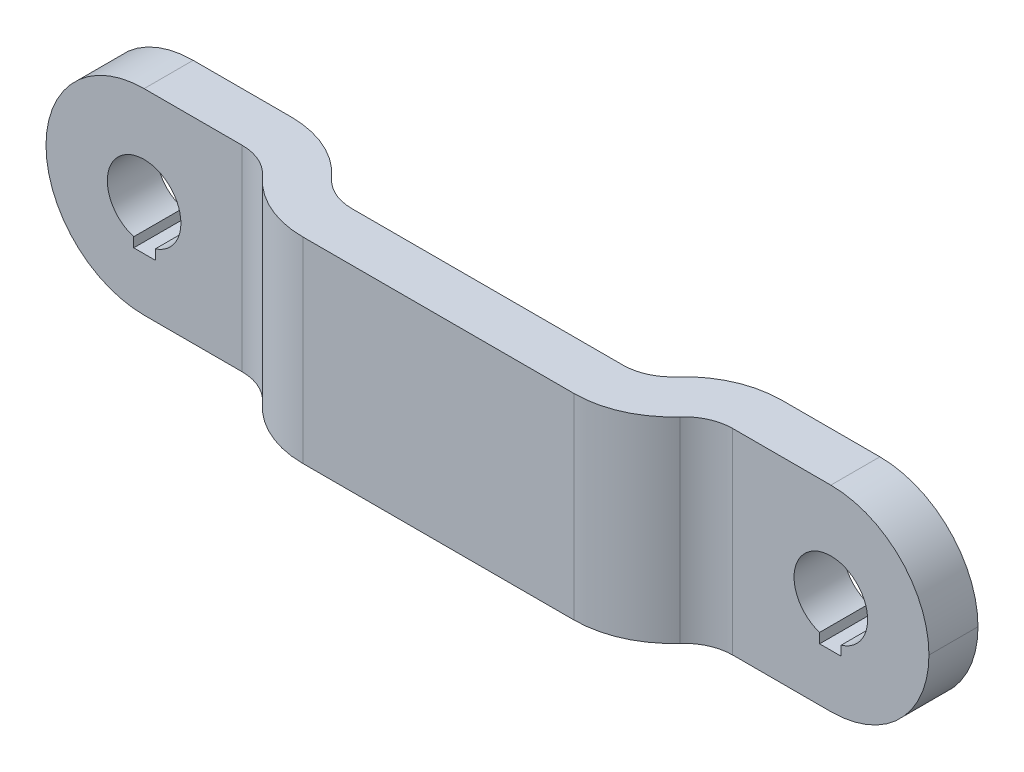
SolidWorks part; units mm, degrees
ref_plane "front" through (0, 0, 0) normal (0, 0, 1) x (1, 0, 0)
ref_plane "top" through (0, 0, 0) normal (0, 1, 0) x (1, 0, 0)
ref_plane "side" through (0, 0, 0) normal (1, 0, 0) x (0, 0, -1)
sketch "Sketch1" plane through (0, 0, 0) normal (0, 1, 0) x (1, 0, 0)
  line L0 (-28.575, 0) -> (-15.875, 0)
  line L1 (-28.575, 0) -> (-28.575, -3.175)
  line L2 (-28.575, -3.175) -> (-15.875, -3.175)
  line L3 (-8.7755, -6.35) -> (8.7755, -6.35)
  line L4 (0, 0) -> (0, 21.9313) construction
  line L5 (-8.7755, -3.175) -> (8.7755, -3.175)
  line L6 (28.575, -3.175) -> (15.875, -3.175)
  line L7 (28.575, 0) -> (28.575, -3.175)
  line L8 (28.575, 0) -> (15.875, 0)
  line L9 (-50, 0) -> (50, 0) construction
  arc A0 (-15.875, -3.175) -> (-13.5085, -4.2333) centre (-15.875, -6.35) cw
  arc A1 (-13.5085, -4.2333) -> (-8.7755, -6.35) centre (-8.7755, 0) ccw
  arc A2 (-15.875, 0) -> (-11.142, -2.1167) centre (-15.875, -6.35) cw
  arc A3 (-11.142, -2.1167) -> (-8.7755, -3.175) centre (-8.7755, 0) ccw
  arc A4 (11.142, -2.1167) -> (8.7755, -3.175) centre (8.7755, 0) cw
  arc A5 (15.875, 0) -> (11.142, -2.1167) centre (15.875, -6.35) ccw
  arc A6 (13.5085, -4.2333) -> (8.7755, -6.35) centre (8.7755, 0) cw
  arc A7 (15.875, -3.175) -> (13.5085, -4.2333) centre (15.875, -6.35) ccw
  dimension "D5" = 6.35
  dimension "D3" = 6.35
  dimension "D1" = 3.175
  dimension "D2" = 57.15
  dimension "D4" = 31.75
  dimension "D7" = 3.175
extrude "Base-Extrude" add sketch "Sketch1" along normal mid plane 12.7
fillet "Fillet1" radius 6.35 8 edges at (28.575, -6.35, 1.5875) (-28.575, -6.35, 1.5875) (-28.575, 0, 0) (28.575, 0, 0) (28.575, 0, 3.175) (-28.575, 0, 3.175) (28.575, 6.35, 1.5875) (-28.575, 6.35, 1.5875)
sketch "Sketch2" plane through (0, 0, 3.175) normal (0, 0, 1) x (1, 0, 0)
  line L0 (0, 0) -> (0, 14.5198) construction
  line L1 (-22.8956, -2.2849) -> (-22.8956, -2.9089)
  line L2 (-21.4987, -2.9089) -> (-22.8956, -2.9089)
  line L3 (21.4987, -2.2678) -> (21.4987, -2.9089)
  line L4 (21.4987, -2.9089) -> (22.8956, -2.9089)
  line L5 (22.8956, -2.2849) -> (22.8956, -2.9089)
  line L6 (-21.4987, -2.2678) -> (-21.4987, -2.9089)
  arc A0 (22.8956, -2.2849) -> (21.4987, -2.2678) centre (22.225, 0) ccw
  arc A1 (-22.8956, -2.2849) -> (-21.4987, -2.2678) centre (-22.225, 0) cw
  arc A2 (28.575, 0) -> (22.225, 6.35) centre (22.225, 0) ccw construction
  dimension "D1" = 4.7625
extrude "Cut-Extrude1" cut sketch "Sketch2" against normal through all
